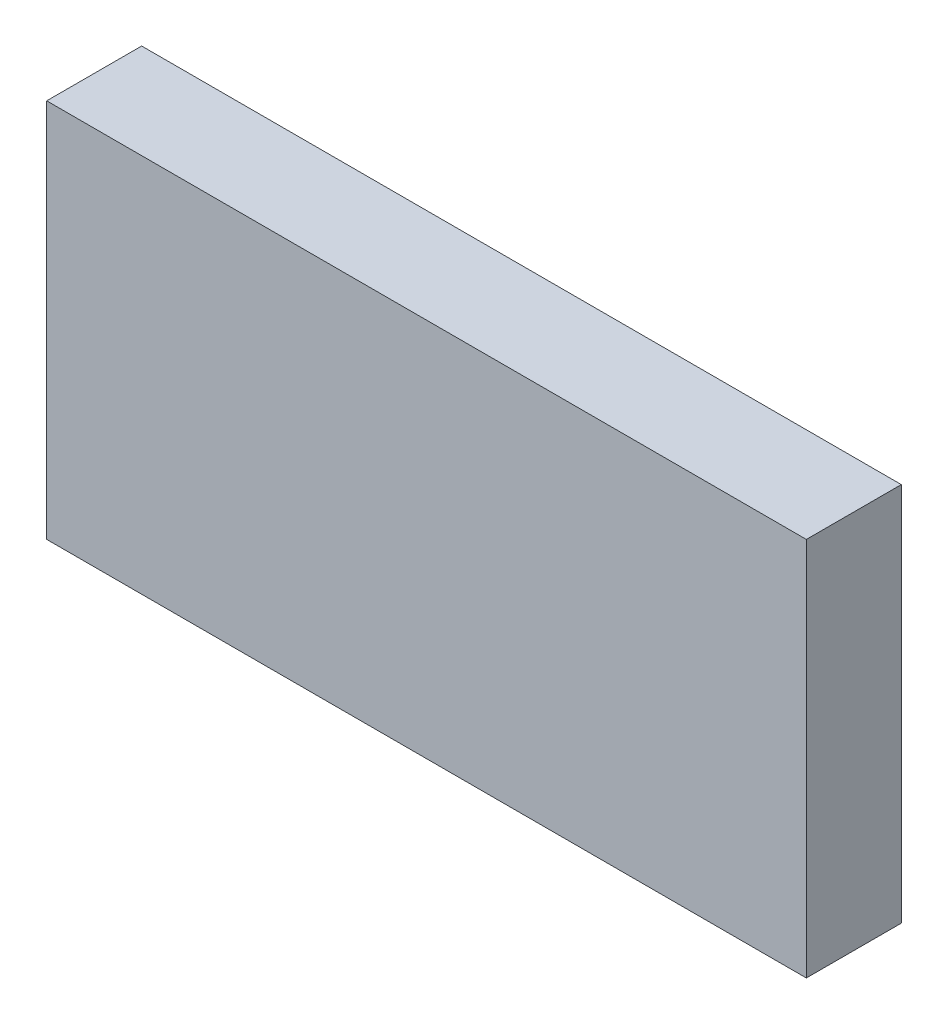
SolidWorks part; units mm, degrees
ref_plane "Front" through (0, 0, 0) normal (0, 0, 1) x (1, 0, 0)
ref_plane "Top" through (0, 0, 0) normal (0, 1, 0) x (1, 0, 0)
ref_plane "Right" through (0, 0, 0) normal (1, 0, 0) x (0, 0, -1)
sketch "Sketch1" plane through (0, 0, 0) normal (0, 0, 1) x (1, 0, 0)
  line L0 (-25.4, 12.7) -> (25.4, -12.7) construction
  line L1 (-25.4, -12.7) -> (25.4, -12.7)
  line L2 (-25.4, -12.7) -> (-25.4, 12.7)
  line L3 (-25.4, 12.7) -> (25.4, 12.7)
  line L4 (25.4, -12.7) -> (25.4, 12.7)
  dimension "D1" = 25.4
  dimension "D2" = 50.8
extrude "Extrude1" add sketch "Sketch1" along normal blind 6.35
